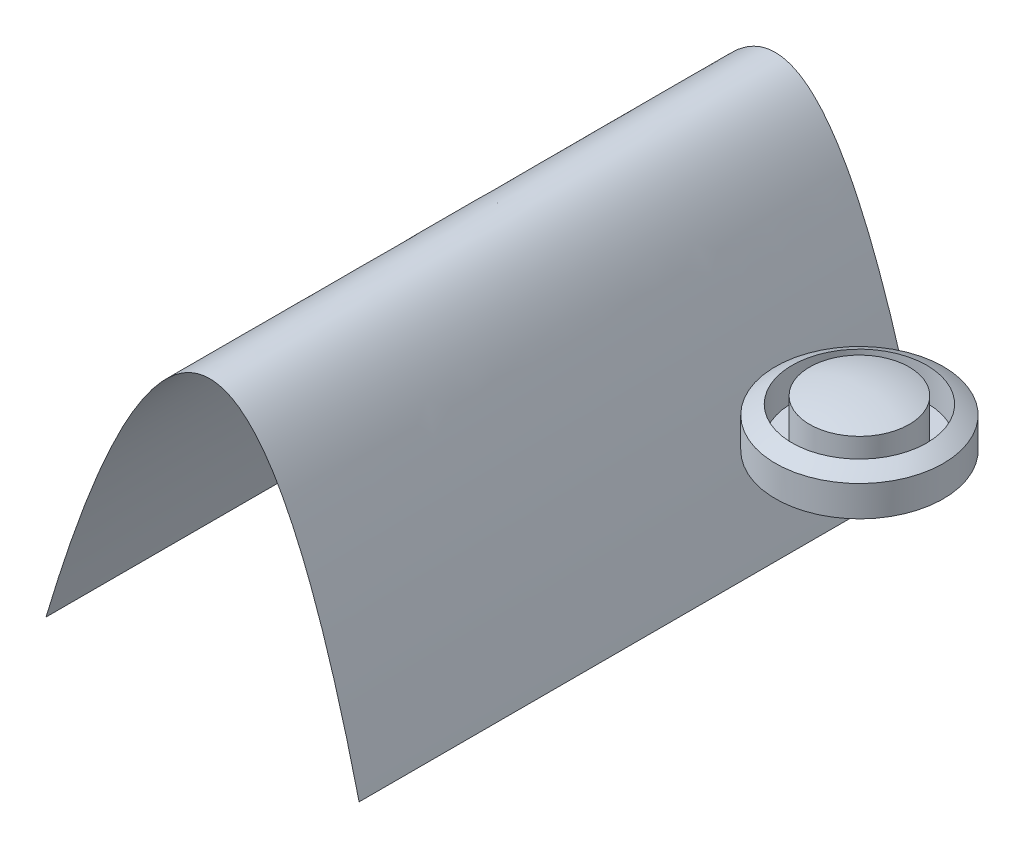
SolidWorks part; units mm, degrees
ref_plane "Front Plane" through (0, 0, 0) normal (0, 0, 1) x (1, 0, 0)
ref_plane "Top Plane" through (0, 0, 0) normal (0, 1, 0) x (1, 0, 0)
ref_plane "Right Plane" through (0, 0, 0) normal (1, 0, 0) x (0, 0, -1)
sketch "Sketch1" plane through (0, 0, 0) normal (0, 0, 1) x (1, 0, 0)
  line L0 (0, 0) -> (0, 43.8386) construction
  line L1 (0, 43.8386) -> (-18.6506, 43.8386) construction
  line L2 (39.224, 37.3013) -> (39.224, 5.7682)
  line L3 (39.224, 5.7682) -> (53.0678, 5.7682)
  line L4 (53.0678, 5.7682) -> (53.0678, 10.9597)
  line L5 (53.0678, 10.9597) -> (66.1425, 10.9597)
  line L6 (66.1425, 10.9597) -> (66.1425, 0)
  line L7 (66.1425, 0) -> (0, 0)
  line L8 (0, 0) -> (0, 43.8386)
  arc A0 (0, 43.8386) -> (39.224, 37.3013) centre (0, -77.1021) cw
revolve "Revolve1" add sketch "Sketch1" angle 360 about L8
sketch "Sketch2" plane through (0, 0, 0) normal (0, 0, 1) x (1, 0, 0)
  spline S0 degree 2 poles (-306.2182, 0) (-235.5254, 135.0823) (-172.0557, 0) knots 0 0 0 1 1 1
surface "Surface-Extrude1" sketch "Sketch2" parameters "D1"=103.632
surface "Surface-Extend1" parameters "D1"=170.942, "D2"=170.942, "D3"=170.942
surface "Surface-Offset2" parameters "D1"=0
surface "Surface-Extend2" parameters "D1"=50.8
sketch "Sketch3" plane through (0, 10.9597, 0) normal (0, 1, 0) x (1, 0, 0)
  circle A0 centre (0, 0) radius 53.0678 construction
  circle A1 centre (0, 0) radius 66.1425
  circle A2 centre (0, 0) radius 66.1425
  circle A3 centre (0, 0) radius 53.0678
  dimension "D1" = 0
extrude "Boss-Extrude1" add sketch "Sketch3" along normal up to surface (20.6142 mm away)
